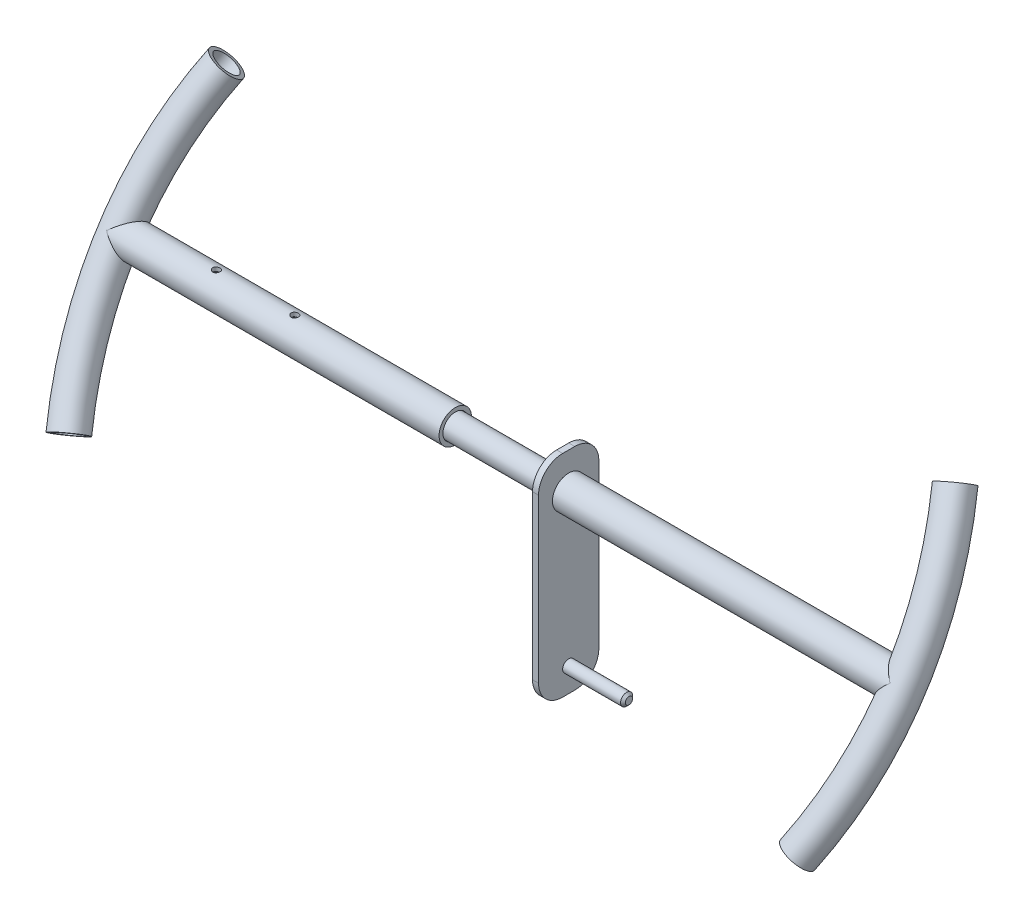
SolidWorks part; units mm, degrees
ref_plane "Plan de face" through (0, 0, 0) normal (0, 0, 1) x (1, 0, 0)
ref_plane "Plan de dessus" through (0, 0, 0) normal (0, 1, 0) x (1, 0, 0)
ref_plane "Plan de droite" through (0, 0, 0) normal (1, 0, 0) x (0, 0, -1)
sketch "Esquisse1" plane through (0, 0, 0) normal (0, 0, 1) x (1, 0, 0)
  line L0 (-290, 0) -> (290, 0)
  dimension "D1" = 580
other "Elément mécano-soudé1"
ref_plane "Plan1" through (-290, 0, 0) normal (1, 0, 0) x (0, 0, -1)
sketch "Esquisse11" plane through (-290, 0, 0) normal (1, 0, 0) x (0, 0, -1)
  line L0 (-10, 0) -> (10, 0) construction
  line L1 (0, 10) -> (0, -10) construction
  circle A0 centre (0, 0) radius 10
  point P7 (0, 0)
  dimension "D1" = 20
ref_plane "Plan8" through (0, 0, 0) normal (0, 0.5446, 0.8387) x (1, 0, 0)
sketch "Esquisse13" plane through (0, 0, 0) normal (0, 0.5446, 0.8387) x (1, 0, 0)
  line L0 (290, 0) -> (325, 0) construction
  arc A0 (302.0348, 120) -> (302.0348, -120) centre (0, 0) cw
  dimension "D1" = 325
  dimension "D2" = 120
other "Elément mécano-soudé2"
ref_plane "Plan2" through (302.0348, 100.6405, -65.3567) normal (0.3692, -0.7794, 0.5062) x (0.9074, 0.4201, -0.0151)
sketch "Sketch1" plane through (302.0348, 100.6405, -65.3567) normal (0.3692, -0.7794, 0.5062) x (0.9074, 0.4201, -0.0151)
  circle A0 centre (0, 0) radius 10.25
  circle A1 centre (0, 0) radius 13.45
  point P3 (0, 0)
  dimension "In_dia" = 20.5
  dimension "Out_dia" = 26.9
sketch "Esquisse19" plane through (0, 0, 0) normal (0, 0, 1) x (1, 0, 0)
  line L0 (47, 0) -> (325, 0)
  line L1 (-290, 0) -> (290, 0) construction
  dimension "D1" = 243
other "Elément mécano-soudé3"
ref_plane "Plan5" through (47, 0, 0) normal (1, 0, 0) x (0, 0, -1)
sketch "Sketch13" plane through (47, 0, 0) normal (1, 0, 0) x (0, 0, -1)
  circle A0 centre (0, 0) radius 10.25
  circle A1 centre (0, 0) radius 13.45
  point P3 (0, 0)
  dimension "In_dia" = 20.5
  dimension "Out_dia" = 26.9
other "Ajuster/Prolonger1"
sketch "Esquisse21" plane through (47, 0, 0) normal (-1, 0, 0) x (0, 0, 1)
  line L0 (0, 30) -> (0, -145)
  dimension "D1" = 30
  dimension "D2" = 145
other "Elément mécano-soudé4"
ref_plane "Plan6" through (47, 30, 0) normal (0, -1, 0) x (1, 0, 0)
sketch "Esquisse110" plane through (44.5, 30, 0) normal (0, -1, 0) x (0, 0, -1)
  line L0 (0, 2.5) -> (0, -2.5) construction
  line L1 (-25, 2.5) -> (25, 2.5)
  line L2 (-25, 2.5) -> (-25, -2.5)
  line L3 (-25, -2.5) -> (25, -2.5)
  line L4 (25, 2.5) -> (25, -2.5)
  line L5 (-25, 0) -> (25, 0) construction
  point P8 (0, 0)
  dimension "D1" = 50
  dimension "D2" = 5
sketch "Esquisse111" plane through (42, 0, 0) normal (-1, 0, 0) x (0, 0, 1)
  circle A1 centre (0, -125) radius 5
  dimension "D2" = 10
extrude "Enlèv. mat.-Extru.2" cut sketch "Esquisse111" against normal up to next
fillet "Congé1" radius 20 4 edges at (44.5, -145, -25) (44.5, -145, 25) (44.5, 30, 25) (44.5, 30, -25)
sketch "Esquisse112" plane through (0, 0, 0) normal (0, 0, 1) x (1, 0, 0)
  line L0 (44, -125) -> (97, -125)
  line L2 (47, 30) -> (47, -145) construction
  line L4 (47, -130) -> (47, -120) construction
  point P4 (47, -125)
  dimension "D1" = 3
  dimension "D2" = 50
other "Elément mécano-soudé5"
ref_plane "Plan7" through (44, -125, 0) normal (1, 0, 0) x (0, 0, -1)
sketch "Esquisse114" plane through (44, -125, 0) normal (1, 0, 0) x (0, 0, -1)
  line L0 (0, 5) -> (0, -5) construction
  line L1 (-5, 0) -> (5, 0) construction
  circle A0 centre (0, 0) radius 5
  point P7 (0, 0)
  dimension "D1" = 10
chamfer "Chanfrein1" distance 2 angle 45 1 edges at (97, -125, -5)
mirror "Symétrie1" about plane through (0, 0, 0) normal (1, 0, 0)
sketch "Esquisse12" plane through (0, 0, 0) normal (0, 1, 0) x (1, 0, 0)
  line L0 (-290, 0) -> (290, 0) construction
  circle A0 centre (-245, 0) radius 3
  circle A1 centre (-180, 0) radius 3
  dimension "D1" = 6
  dimension "D2" = 65
  dimension "D3" = 180
extrude "Enlèv. mat.-Extru.1" cut sketch "Esquisse12" against normal through all and the other way through all
